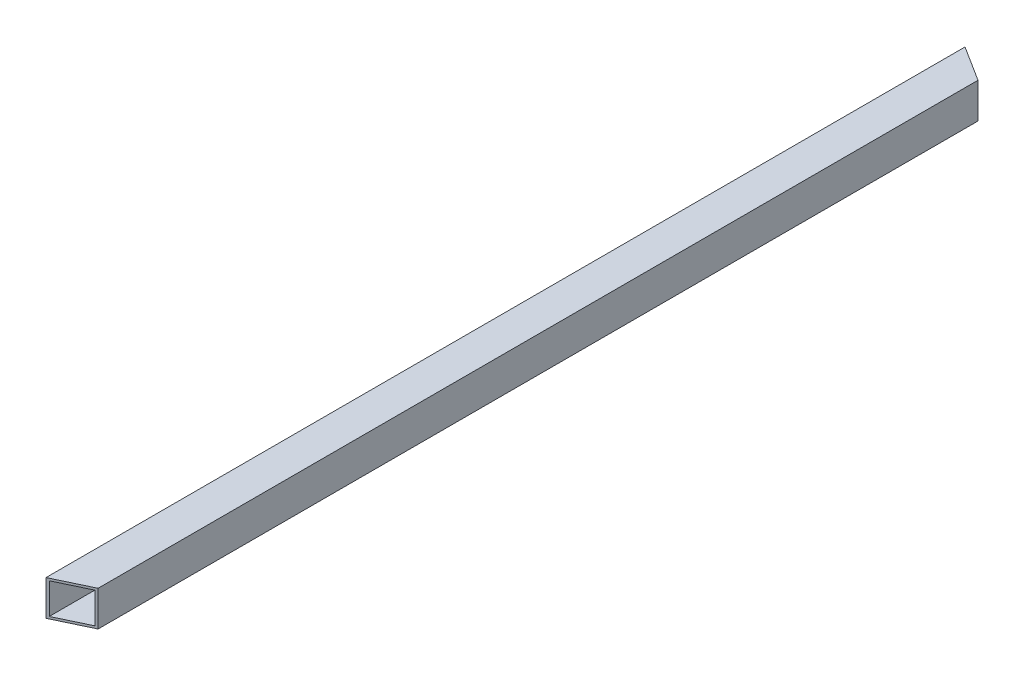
SolidWorks part; units mm, degrees
ref_plane "Front" through (0, 0, 0) normal (0, 0, 1) x (1, 0, 0)
ref_plane "Top" through (0, 0, 0) normal (0, 1, 0) x (1, 0, 0)
ref_plane "Right" through (0, 0, 0) normal (1, 0, 0) x (0, 0, -1)
sketch "Sketch1" plane through (0, 0, 0) normal (0, 0, 1) x (1, 0, 0)
  line L0 (3.175, 3.175) -> (47.625, 3.175)
  line L1 (0, 0) -> (50.8, 0)
  line L2 (0, 0) -> (0, 50.8)
  line L3 (0, 50.8) -> (50.8, 50.8)
  line L4 (50.8, 0) -> (50.8, 50.8)
  line L5 (47.625, 3.175) -> (47.625, 47.625)
  line L6 (3.175, 47.625) -> (47.625, 47.625)
  line L7 (3.175, 3.175) -> (3.175, 47.625)
  dimension "D1" = 50.8
  dimension "D2" = 50.8
  dimension "D3" = 3.175
extrude "Extrude1" add sketch "Sketch1" along normal blind 2677.0203
sketch "Sketch2" plane through (0, 0, 0) normal (0, -1, 0) x (1, 0, 0)
  line L0 (-62.4955, 2677.0203) -> (-62.4955, 2605.4129)
  line L2 (50.8, 2677.0203) -> (-62.4955, 2677.0203)
  line L4 (160.0031, 101.1286) -> (160.0031, 0)
  line L5 (160.0031, 0) -> (0, 0)
  line L8 (50.8, 2677.0203) -> (-62.4955, 2605.4129)
  line L9 (0, 0) -> (160.0031, 101.1286)
extrude "Extrude2" cut sketch "Sketch2" against normal through all
sketch "Sketch4" plane through (0, 50.8, 0) normal (0, 1, 0) x (1, 0, 0)
  line L1 (148.5117, -1251.5619) -> (148.5117, -2692.3546)
  line L2 (148.5117, -2692.3546) -> (-37.5204, -2692.3546)
  line L3 (-37.5204, -2692.3546) -> (-37.5204, -1339.9395)
  line L5 (148.5117, -1251.5619) -> (-37.5204, -1339.9395)
extrude "Cut-Extrude1" cut sketch "Sketch4" against normal through all
